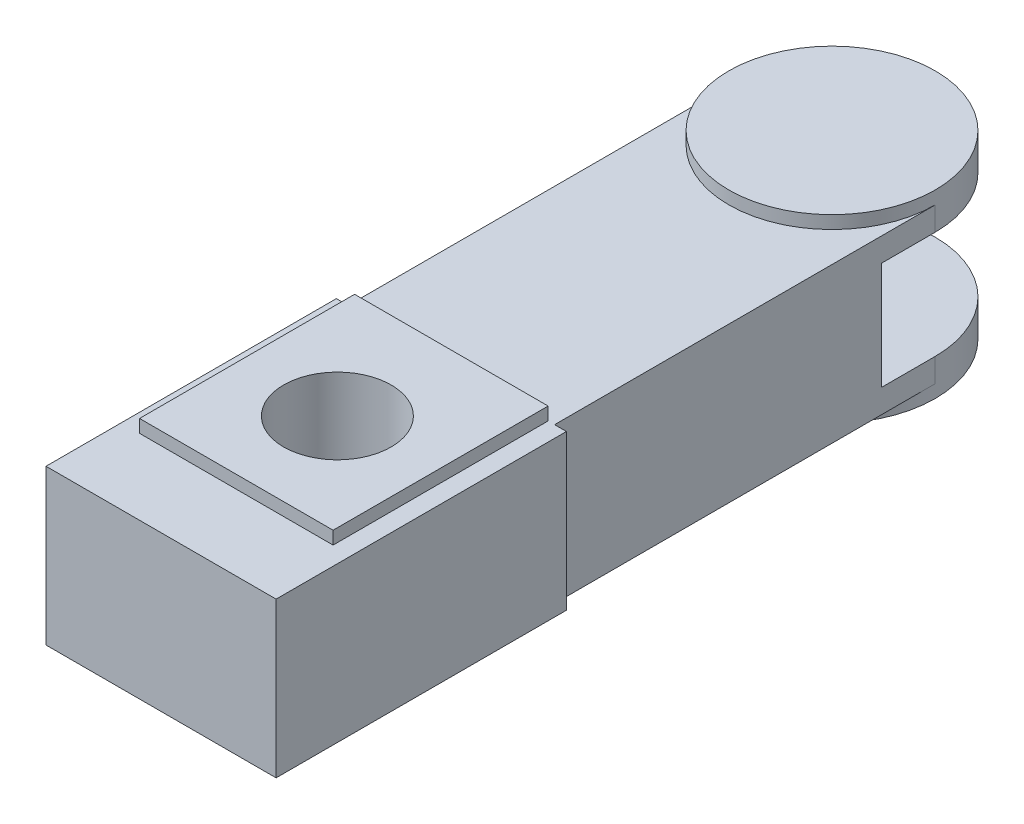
SolidWorks part; units mm, degrees
ref_plane "Front" through (0, 0, 0) normal (0, 0, 1) x (1, 0, 0)
ref_plane "Top" through (0, 0, 0) normal (0, 1, 0) x (1, 0, 0)
ref_plane "Right" through (0, 0, 0) normal (1, 0, 0) x (0, 0, -1)
sketch "Sketch1" plane through (0, 0, 0) normal (0, 1, 0) x (1, 0, 0)
  line L0 (48, 135) -> (48, 312)
  line L1 (-53.5, 0) -> (53.5, 0)
  line L2 (-53.5, 0) -> (-53.5, 135)
  line L3 (-53.5, 135) -> (-48, 135)
  line L4 (53.5, 0) -> (53.5, 135)
  line L5 (-48, 312) -> (-48, 135)
  line L6 (53.5, 135) -> (48, 135)
  arc A0 (48, 312) -> (-48, 312) centre (0, 312) ccw
  dimension "D1" = 96
  dimension "D2" = 312
  dimension "D3" = 135
  dimension "D4" = 48
  dimension "D5" = 107
extrude "Extrude1" add sketch "Sketch1" along normal mid plane 72
sketch "Sketch2" plane through (0, 0, 0) normal (0, 1, 0) x (1, 0, 0)
  line L1 (-53.5, 0) -> (53.5, 0) construction
  line L2 (-45, 135) -> (45, 135)
  line L3 (-45, 135) -> (-45, 35)
  line L4 (-45, 35) -> (45, 35)
  line L5 (45, 135) -> (45, 35)
  circle A0 centre (0, 312) radius 48
  arc A1 (48, 312) -> (-48, 312) centre (0, 312) ccw construction
  dimension "D1" = 96
  dimension "D2" = 35
  dimension "D3" = 100
  dimension "D4" = 90
  dimension "D5" = 45
extrude "Extrude2" add sketch "Sketch2" along normal mid plane 84
sketch "Sketch3" plane through (0, 42, 0) normal (0, 1, 0) x (-1, 0, 0)
  circle A0 centre (0, -82) radius 25
  circle A1 centre (0, -312) radius 48 construction
  dimension "D1" = 230
  dimension "D2" = 50
sketch "Sketch4" plane through (0, 0, 0) normal (0, 1, 0) x (1, 0, 0)
  circle A0 centre (0, 312) radius 48
  circle A1 centre (0, 312) radius 48 construction
  dimension "D1" = 96
extrude "Cut-Extrude1" cut sketch "Sketch4" against normal mid plane 50
sketch "Sketch5" plane through (48, 0, 0) normal (1, 0, 0) x (0, 0, -1)
  line L0 (312, -25) -> (264, -25) construction
  line L1 (312, 25) -> (287, 25)
  line L2 (312, 25) -> (312, -25)
  line L3 (312, -25) -> (287, -25)
  line L4 (287, 25) -> (287, -25)
extrude "Cut-Extrude2" cut sketch "Sketch5" against normal through all
extrude "Cut-Extrude3" cut sketch "Sketch3" against normal blind 50
